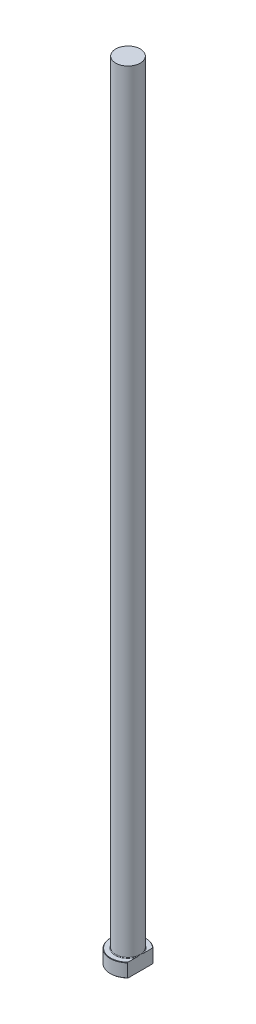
SolidWorks part; units mm, degrees
ref_plane "Front Plane" through (0, 0, 0) normal (0, 0, 1) x (1, 0, 0)
ref_plane "Top Plane" through (0, 0, 0) normal (0, 1, 0) x (1, 0, 0)
ref_plane "Right Plane" through (0, 0, 0) normal (1, 0, 0) x (0, 0, -1)
sketch "Sketch1" plane through (0, 0, 0) normal (0, 0, 1) x (1, 0, 0)
  line L0 (0, 259.9588) -> (0, -15.1925) construction
  line L1 (0, 0) -> (-9, 0)
  line L2 (-9, 0) -> (-9, 7)
  line L3 (-9, 7) -> (-6.25, 7)
  line L4 (-6.25, 7) -> (-6.25, 400)
  line L5 (-6.25, 400) -> (0, 400)
  line L6 (0, 400) -> (0, 0)
  dimension "L" = 400
  dimension "H" = 18
  dimension "T" = 7
  dimension "D" = 12.5
revolve "Revolve1" add sketch "Sketch1" angle 360 about L0
chamfer "Chamfer1" distance 0.2 angle 45 2 edges at (0, 7, 9) (0, 0, 9)
fillet "Fillet1" radius 0.3 1 edges at (0, 7, 6.25)
sketch "Sketch2" plane through (0, 0, 0) normal (0, 1, 0) x (1, 0, 0)
  line L0 (6.25, 6.4759) -> (6.25, -6.4759)
  circle A0 centre (0, 0) radius 9 construction
  arc A1 (6.25, -6.4759) -> (6.25, 6.4759) centre (0, 0) ccw
  circle A2 centre (0, 0) radius 6.25 construction
extrude "KEY" cut sketch "Sketch2" along normal through all
